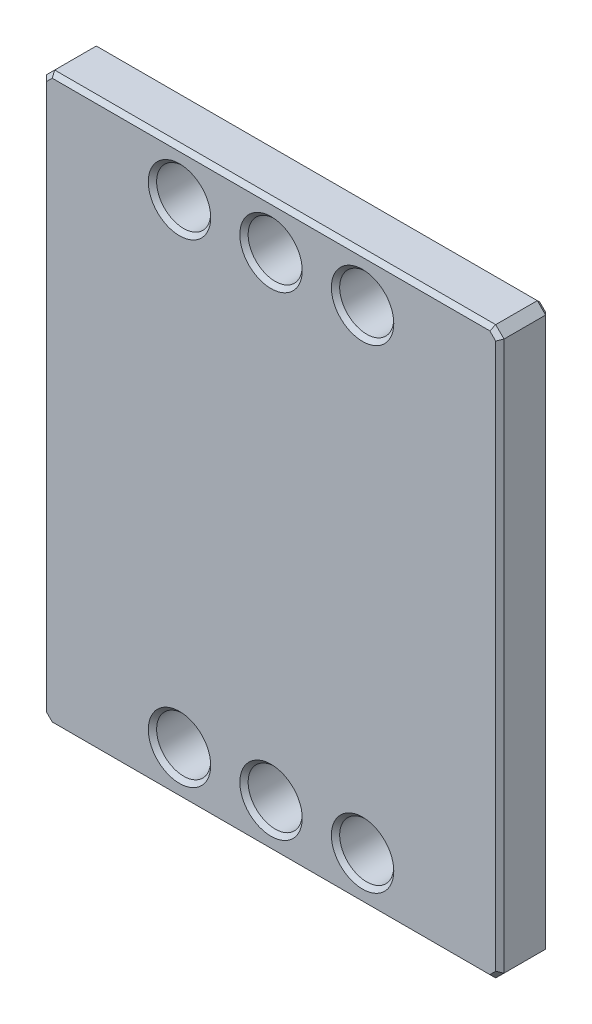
SolidWorks part; units mm, degrees
ref_plane "Plan de face" through (0, 0, 0) normal (0, 0, 1) x (1, 0, 0)
ref_plane "Plan de dessus" through (0, 0, 0) normal (0, 1, 0) x (1, 0, 0)
ref_plane "Plan de droite" through (0, 0, 0) normal (1, 0, 0) x (0, 0, -1)
sketch "Esquisse1" plane through (0, 0, 0) normal (0, 0, 1) x (1, 0, 0)
  line L1 (-27.5, 68) -> (27.5, 68)
  line L2 (-27.5, 68) -> (-27.5, 0)
  line L3 (-27.5, 0) -> (27.5, 0)
  line L4 (27.5, 68) -> (27.5, 0)
  circle A0 centre (-11, 62.5) radius 3.25
  circle A1 centre (0, 62.5) radius 3.25
  circle A2 centre (11, 62.5) radius 3.25
  circle A3 centre (0, 5.5) radius 3.25
  circle A4 centre (11, 5.5) radius 3.25
  circle A5 centre (-11, 5.5) radius 3.25
  dimension "D3" = 6.5
  dimension "D4" = 16.5
  dimension "D5" = 5.5
  dimension "D8" = 11
  dimension "D9" = 57
  dimension "D1" = 68
  dimension "D2" = 55
  dimension "D6" = 3
  dimension "D7" = 2
extrude "Boss.-Extru.1" add sketch "Esquisse1" along normal blind 6
chamfer "Chanfrein1" distance 1 angle 45 4 edges at (27.5, 0, 3) (-27.5, 0, 3) (27.5, 68, 3) (-27.5, 68, 3)
chamfer "Chanfrein2" distance 0.5 angle 45 28 edges at (-7.75, 5.5, 0) (3.25, 5.5, 0) (3.25, 62.5, 0) (27, 67.5, 0) (0, 68, 0) (-27, 67.5, 0) (-27.5, 34, 0) (-27, 0.5, 0) (0, 0, 0) (27, 0.5, 0) (27.5, 34, 0) (-7.75, 62.5, 0) (14.25, 62.5, 0) (14.25, 5.5, 0) (-7.75, 5.5, 6) (3.25, 5.5, 6) (3.25, 62.5, 6) (-27, 0.5, 6) (-27.5, 34, 6) (-27, 67.5, 6) (0, 68, 6) (27, 67.5, 6) (27.5, 34, 6) (27, 0.5, 6) (0, 0, 6) (-7.75, 62.5, 6) (14.25, 62.5, 6) (14.25, 5.5, 6)
